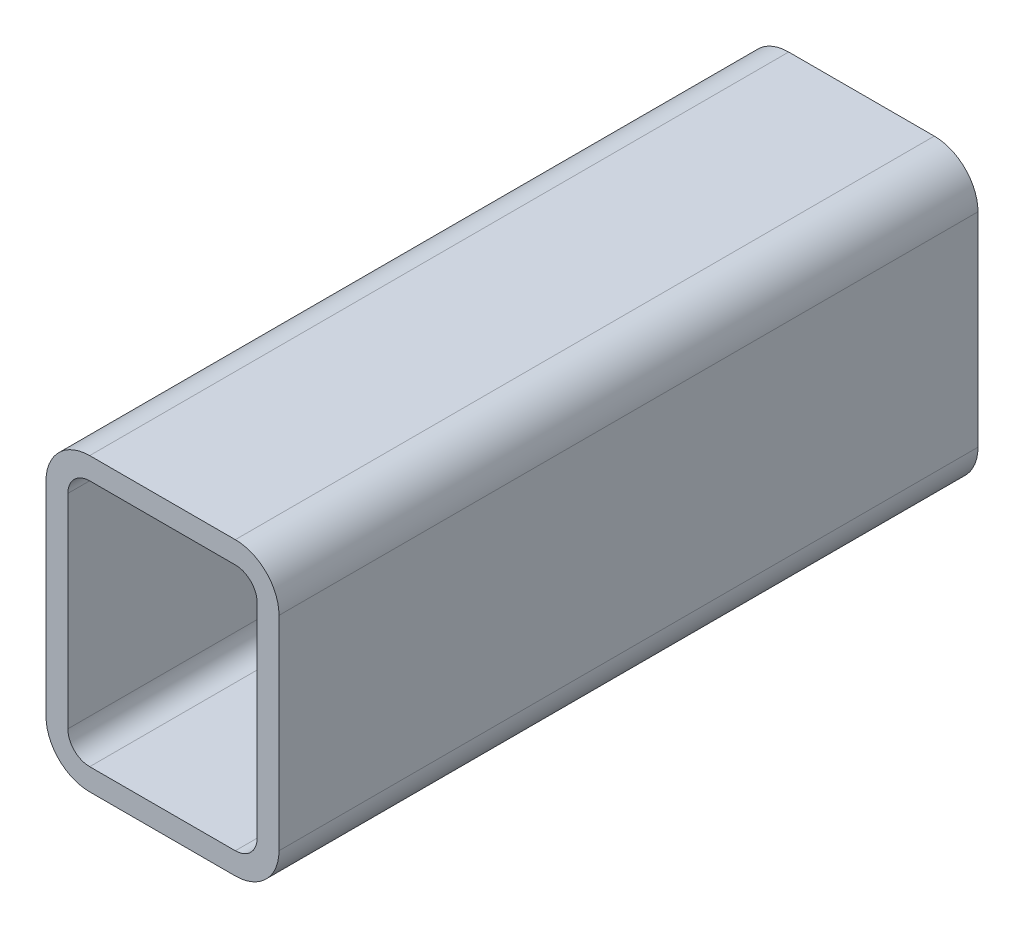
SolidWorks part; units mm, degrees
ref_plane "Front Plane" through (0, 0, 0) normal (0, 0, 1) x (1, 0, 0)
ref_plane "Top Plane" through (0, 0, 0) normal (0, 1, 0) x (1, 0, 0)
ref_plane "Right Plane" through (0, 0, 0) normal (1, 0, 0) x (0, 0, -1)
sketch "Sketch1" plane through (0, 0, 0) normal (0, 0, 1) x (1, 0, 0)
sketch_block_instance "HSS5x4x0.375-1"
sketch_block "HSS5x4x0.375"
extrude "Boss-Extrude1" add sketch "Sketch1" along normal blind 304.8
